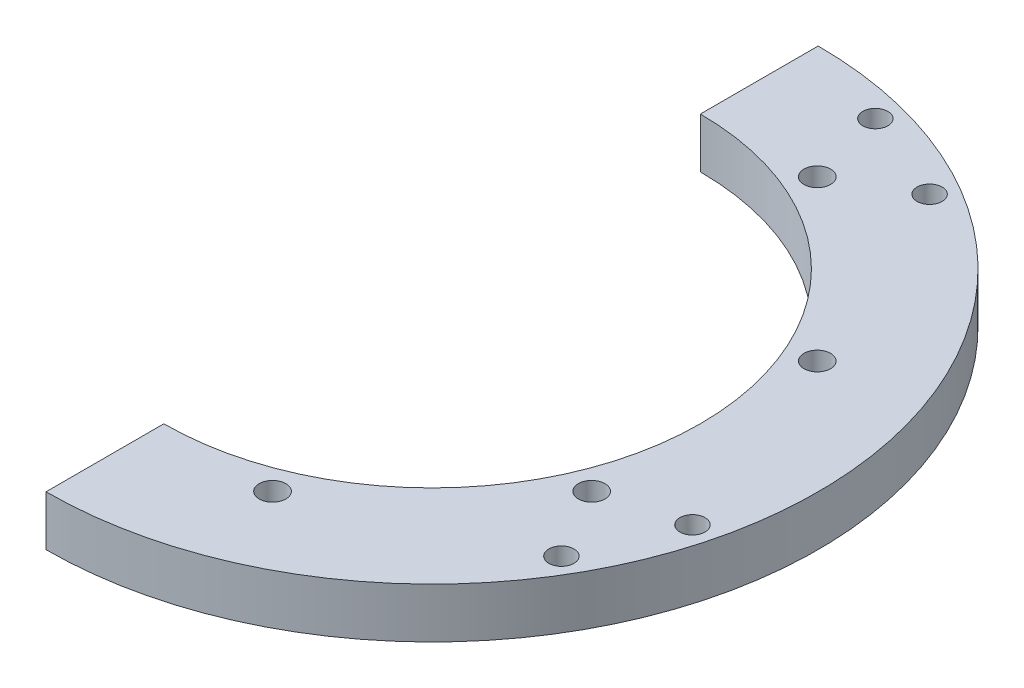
SolidWorks part; units mm, degrees
ref_plane "Front Plane" through (0, 0, 0) normal (0, 0, 1) x (1, 0, 0)
ref_plane "Top Plane" through (0, 0, 0) normal (0, 1, 0) x (1, 0, 0)
ref_plane "Right Plane" through (0, 0, 0) normal (1, 0, 0) x (0, 0, -1)
sketch "Sketch16" plane through (0, 0, 0) normal (0, 1, 0) x (1, 0, 0)
  line L0 (0, 97.79) -> (0, 67.945)
  line L1 (0, -67.945) -> (0, -97.79)
  arc A0 (0, 67.945) -> (0, -67.945) centre (0, 0) cw
  arc A1 (0, 97.79) -> (0, -97.79) centre (0, 0) cw
  dimension "D1" = 67.945
  dimension "D2" = 97.79
extrude "Boss-Extrude1" add sketch "Sketch16" along normal blind 12.7
sketch "Sketch17" plane through (0, 12.7, 0) normal (0, 1, 0) x (1, 0, 0)
  line L0 (23.1655, 89.1132) -> (46.6321, 79.3931) construction
  line L2 (0, 97.79) -> (0, 67.945) construction
  line L3 (0, 0) -> (38.8806, 93.8662) construction
  arc A0 (0, 74.676) -> (28.5773, 68.9916) centre (0, 0) cw
  point P17 (34.8988, 84.2531)
  dimension "D1" = 25.4
  dimension "D2" = 74.676
  dimension "D3" = 92.075
hole_wizard "1/4 Clearance Hole2" positions "Sketch24" profile "Sketch25" hole size "1/4" standard "ANSI Inch"
sketch "Sketch24" plane through (0, 12.7, 0) normal (0, 1, 0) x (1, 0, 0)
  point P0 (28.5773, 68.9916)
sketch "Sketch25" plane through (28.5773, 12.7, -68.9916) normal (1, 0, 0) x (0, 0, 1)
  line L0 (0, 0) -> (0, 12.7)
  line L1 (0, 12.7) -> (3.3782, 12.7)
  line L2 (3.3782, 12.7) -> (3.3782, 0)
  line L5 (3.3782, 0) -> (0, 0)
  line L11 (0, -6.35) -> (0, 107.95) construction
  dimension "Thru Hole Dia." = 6.7564
  dimension "Thru Hole Depth" = 12.7
hole_wizard "1/4-20 Tapped Hole3" positions "Sketch37" profile "Sketch38" tap size "1/4-20" standard "ANSI Inch"
sketch "Sketch37" plane through (0, 12.7, 0) normal (0, 1, 0) x (1, 0, 0)
  point P0 (23.1655, 89.1132)
  point P3 (46.6321, 79.3931)
sketch "Sketch38" plane through (23.1655, 12.7, -89.1132) normal (1, 0, 0) x (0, 0, 1)
  line L0 (0, 0) -> (0, 12.7)
  line L1 (0, 12.7) -> (3.175, 12.7)
  line L2 (3.175, 12.7) -> (3.175, 0)
  line L5 (3.175, 0) -> (0, 0)
  line L11 (0, -6.35) -> (0, 107.95) construction
  dimension "Thread Major Dia." = 6.35
  dimension "Thru Tap Drill Depth" = 12.7
pattern_circular "CirPattern6" count 4 over 135 about axis through (0, 0, 0) along (0, 1, 0) of "1/4 Clearance Hole2"
pattern_circular "CirPattern7" count 2 over 90 about axis through (0, 0, 0) along (0, 1, 0) of "1/4-20 Tapped Hole3"
